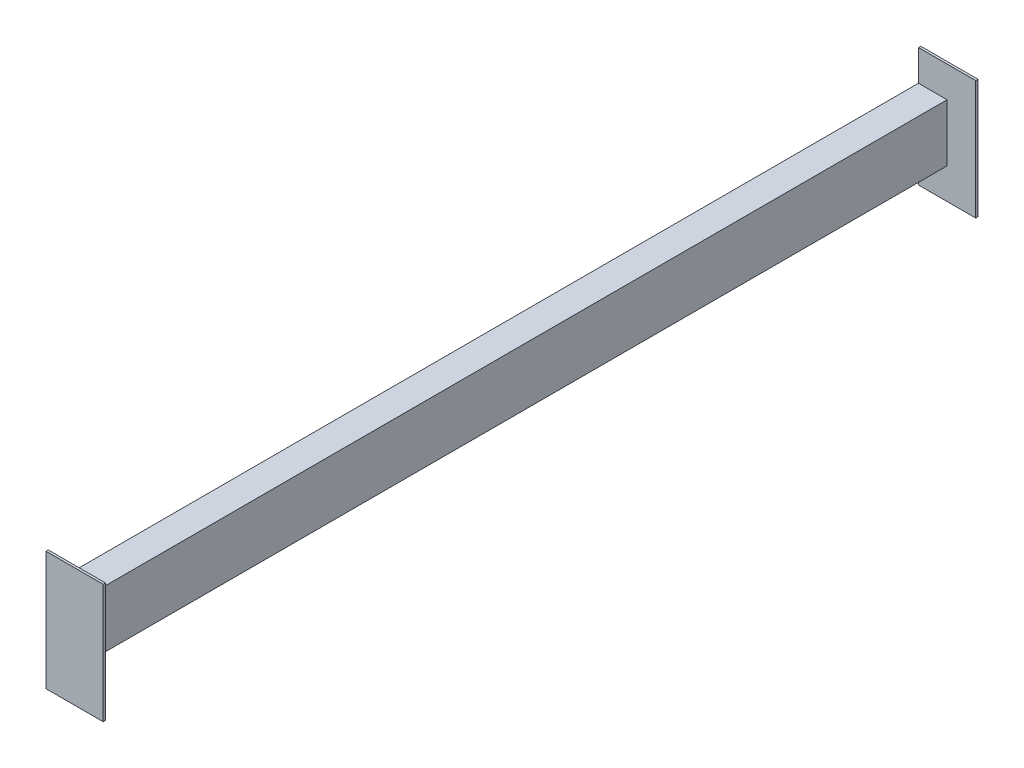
SolidWorks part; units mm, degrees
ref_plane "Plan de face" through (0, 0, 0) normal (0, 0, 1) x (1, 0, 0)
ref_plane "Plan de dessus" through (0, 0, 0) normal (0, 1, 0) x (1, 0, 0)
ref_plane "Plan de droite" through (0, 0, 0) normal (1, 0, 0) x (0, 0, -1)
sketch "Esquisse1" plane through (0, 0, 0) normal (0, 0, 1) x (1, 0, 0)
  line L0 (23, 2) -> (23, 48)
  line L1 (0, 0) -> (25, 0)
  line L2 (0, 0) -> (0, 50)
  line L3 (0, 50) -> (25, 50)
  line L4 (25, 0) -> (25, 50)
  line L5 (2, 48) -> (23, 48)
  line L6 (2, 2) -> (2, 48)
  line L7 (2, 2) -> (23, 2)
  dimension "D1" = 50
  dimension "D2" = 25
  dimension "D3" = 2
extrude "Extrusion1" add sketch "Esquisse1" along normal blind 760
sketch "Esquisse2" plane through (0, 0, 760) normal (0, 0, 1) x (1, 0, 0)
  line L0 (25, 50) -> (0, 50) construction
  line L1 (0, 77) -> (50, 77)
  line L2 (0, 77) -> (0, -27)
  line L3 (0, -27) -> (50, -27)
  line L4 (50, 77) -> (50, -27)
  dimension "D1" = 50
  dimension "D2" = 104
  dimension "D3" = 27
extrude "Extrusion2" add sketch "Esquisse2" along normal blind 2
sketch "Esquisse5" plane through (0, 0, 0) normal (0, 0, -1) x (-1, 0, 0)
  line L1 (-50, 77) -> (0, 77)
  line L2 (-50, 77) -> (-50, -27)
  line L3 (-50, -27) -> (0, -27)
  line L4 (0, 77) -> (0, -27)
extrude "Extrusion3" add sketch "Esquisse5" along normal blind 2
